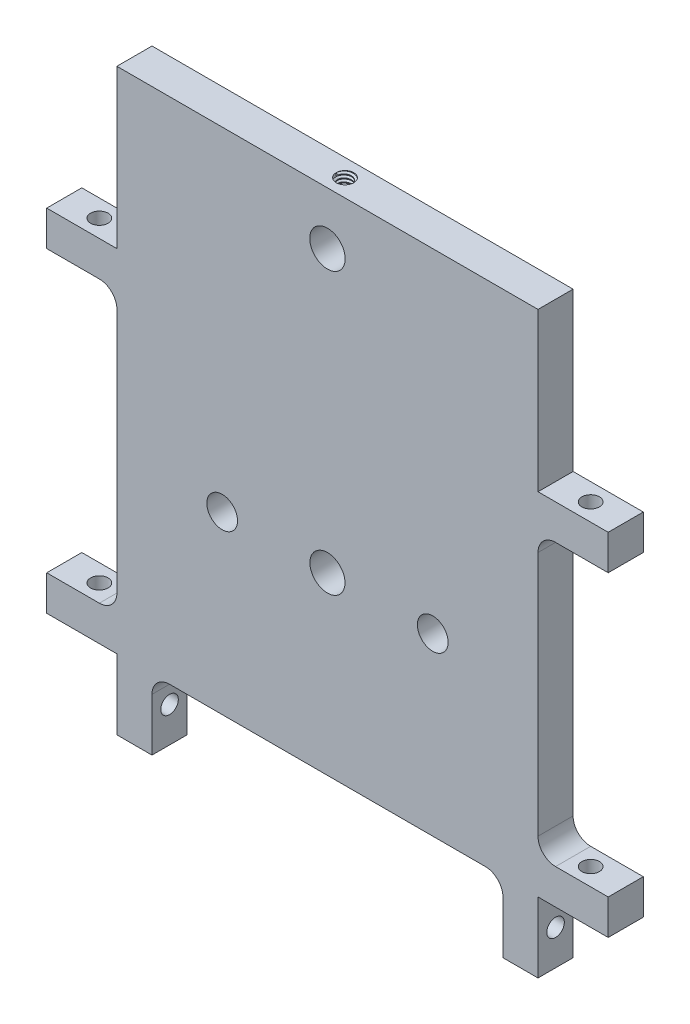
SolidWorks part; units mm, degrees
ref_plane "Front Plane" through (0, 0, 0) normal (0, 0, 1) x (1, 0, 0)
ref_plane "Top Plane" through (0, 0, 0) normal (0, 1, 0) x (1, 0, 0)
ref_plane "Right Plane" through (0, 0, 0) normal (1, 0, 0) x (0, 0, -1)
sketch "Sketch1" plane through (0, 0, 0) normal (0, 0, 1) x (1, 0, 0)
  line L0 (-76.2, -88.9) -> (-63.5, -88.9)
  line L1 (-63.5, -88.9) -> (-63.5, -63.5)
  line L2 (-63.5, -63.5) -> (63.5, -63.5)
  line L3 (63.5, -63.5) -> (63.5, -88.9)
  line L4 (63.5, -88.9) -> (76.2, -88.9)
  line L5 (0, 0) -> (-38.1, 0) construction
  line L6 (0, 0) -> (0, -63.5) construction
  line L7 (-101.6, -50.8) -> (-76.2, -50.8)
  line L8 (101.6, -50.8) -> (76.2, -50.8)
  line L9 (-76.2, -50.8) -> (-76.2, 50.8)
  line L10 (-76.2, -88.9) -> (-76.2, -63.5)
  line L11 (-76.2, -63.5) -> (-101.6, -63.5)
  line L12 (-101.6, -63.5) -> (-101.6, -50.8)
  line L13 (-76.2, 120.65) -> (76.2, 120.65)
  line L14 (76.2, 120.65) -> (76.2, 63.5)
  line L15 (-101.6, 50.8) -> (101.6, 50.8) construction
  line L16 (101.6, 50.8) -> (76.2, 50.8)
  line L17 (101.6, 50.8) -> (101.6, 63.5)
  line L18 (101.6, -50.8) -> (101.6, -63.5)
  line L19 (101.6, -63.5) -> (76.2, -63.5)
  line L20 (76.2, -63.5) -> (76.2, -88.9)
  line L21 (101.6, 63.5) -> (76.2, 63.5)
  line L22 (-76.2, 50.8) -> (-101.6, 50.8)
  line L23 (-101.6, 50.8) -> (-101.6, 63.5)
  line L24 (-101.6, 63.5) -> (-76.2, 63.5)
  line L25 (-76.2, 63.5) -> (-76.2, 120.65)
  line L26 (76.2, 50.8) -> (76.2, -50.8)
  circle A0 centre (0, 0) radius 6.35
  circle A1 centre (38.1, 0) radius 5.5562
  circle A3 centre (-38.1, 0) radius 5.5562
  dimension "D3" = 12.7
  dimension "D6" = 88.9
  dimension "D8" = 11.1125
  dimension "D1" = 12.7
  dimension "D2" = 25.4
  dimension "D4" = 203.2
  dimension "D5" = 38.1
  dimension "D7" = 152.4
  dimension "D9" = 209.55
  dimension "D10" = 114.3
extrude "Boss-Extrude1" add sketch "Sketch1" along normal blind 12.7
sketch "Sketch2" plane through (0, -50.8, 0) normal (0, 1, 0) x (1, 0, 0)
  line L0 (-101.6, -12.7) -> (-101.6, 0) construction
  line L1 (-88.9, -6.35) -> (-101.6, -6.35) construction
  circle A0 centre (-88.9, -6.35) radius 3.175
  dimension "D1" = 6.35
  dimension "D2" = 12.7
extrude "Cut-Extrude1" cut sketch "Sketch2" against normal through all
mirror "Mirror1" about plane through (0, 0, 0) normal (1, 0, 0) of "Cut-Extrude1"
sketch "Sketch3" plane through (76.2, 0, 0) normal (1, 0, 0) x (0, 0, -1)
  line L0 (-6.35, -76.2) -> (-6.35, -88.9) construction
  line L1 (-12.7, -88.9) -> (0, -88.9) construction
  circle A0 centre (-6.35, -76.2) radius 3.175
  dimension "D1" = 6.35
  dimension "D2" = 12.7
extrude "Cut-Extrude2" cut sketch "Sketch3" against normal through all and the other way through all
ref_point "Point1"
sketch "Sketch5" plane through (0, 120.65, 0) normal (0, 1, 0) x (1, 0, 0)
  circle A0 centre (0, -6.35) radius 3.175
  dimension "D1" = 6.35
extrude "Cut-Extrude3" cut sketch "Sketch5" against normal blind 19.05
thread "Thread1" pitch 1.27 start angle 0, offset 0, length 17.78, pitch 1.27, diameter 6.35
ref_plane "Plane1" through (-3.175, 120.65, 6.35) normal (0, 0, 1) x (-1, 0, 0)
sketch "Thread Profile1" plane through (-3.175, 120.65, 6.35) normal (0, 0, 1) x (-1, 0, 0)
  line L0 (0, 0) -> (0, 1.27) construction
  line L11 (0, 0) -> (0, 1.1112)
  line L12 (0, 1.1112) -> (-0.6874, 0.7144)
  line L13 (-0.6874, 0.7144) -> (-0.6874, 0.3969)
  line L15 (-0.6874, 0.3969) -> (0, 0)
  line L17 (-0.6874, 0.5556) -> (0, 0.5556) construction
  point P2 (0, 0)
  dimension "Pitch" = 1.27
  dimension "Profile_Angle" = 60
  dimension "Profile_Land" = 0.3175
  dimension "Profile_Height" = 0.6874
sketch "Sketch9" plane through (0, 0, 12.7) normal (0, 0, 1) x (1, 0, 0)
  line L0 (76.2, 120.65) -> (-76.2, 120.65) construction
  line L1 (0, 101.6) -> (0, 0) construction
  circle A0 centre (0, 101.6) radius 6.4135
  dimension "D1" = 19.05
  dimension "D2" = 12.827
extrude "Cut-Extrude4" cut sketch "Sketch9" against normal through all
mirror "Mirror2" about plane through (0, 0, 0) normal (0, 1, 0) of "Mirror1", "Cut-Extrude1"
fillet "Fillet1" radius 6.35 6 edges at (-76.2, 50.8, 6.35) (-76.2, -50.8, 6.35) (-63.5, -63.5, 6.35) (63.5, -63.5, 6.35) (76.2, -50.8, 6.35) (76.2, 50.8, 6.35)
